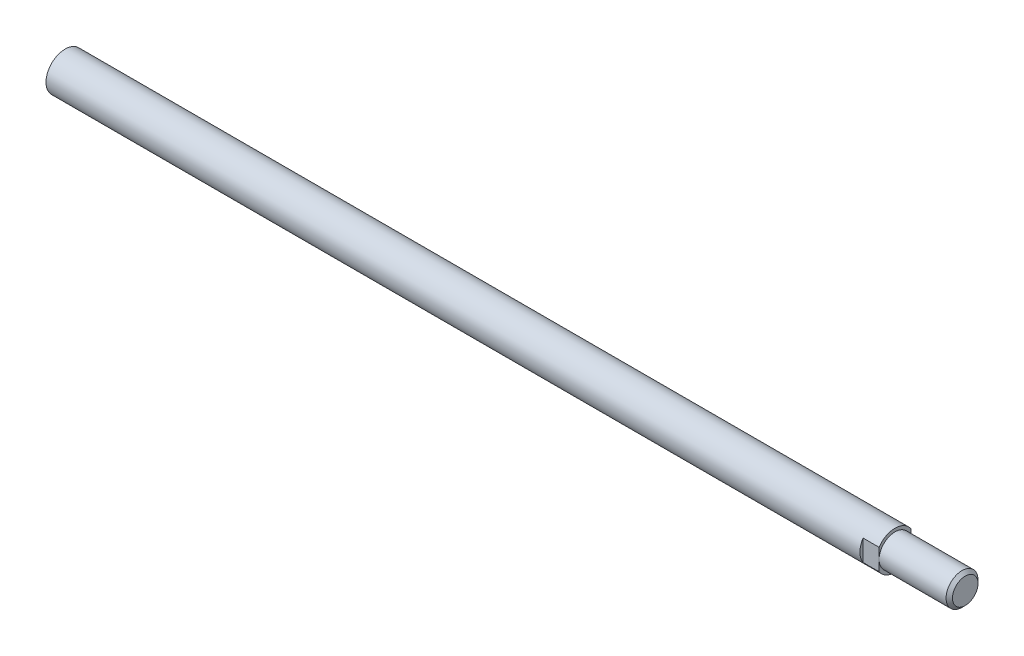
SolidWorks part; units mm, degrees
ref_plane "Vorderseite" through (0, 0, 0) normal (0, 0, 1) x (1, 0, 0)
ref_plane "oben" through (0, 0, 0) normal (0, 1, 0) x (-1, 0, 0)
ref_plane "rechts" through (0, 0, 0) normal (1, 0, 0) x (0, 0, -1)
sketch "Skizze1" plane through (0, 0, 0) normal (0, 0, 1) x (1, 0, 0)
  line L0 (25.5329, 0) -> (-263, 0) construction
  line L1 (0, 0) -> (-260, 0)
  line L2 (0, 5) -> (0, 6)
  line L3 (0, 6) -> (-260, 6)
  line L4 (-260, 0) -> (-260, 6)
  line L5 (0, 0) -> (22, 0)
  line L7 (0, 5) -> (22, 5)
  line L8 (22, 0) -> (22, 5)
  dimension "D2" = 10
  dimension "D3" = 12
  dimension "D4" = 22
  dimension "D5" = 260
revolve "Rotation1" add sketch "Skizze1" angle 360 about L0
chamfer "Fase1" distance 1 angle 45 1 edges at (22, 5, 0)
sketch "Skizze2" plane through (0, 0, 0) normal (0, 1, 0) x (-1, 0, 0)
  line L0 (-21, -5) -> (0, -5) construction
  line L1 (0, -6) -> (5, -6)
  line L2 (0, -6) -> (0, -5)
  line L3 (0, -5) -> (5, -5)
  line L4 (5, -6) -> (5, -5)
  line L5 (0, 6) -> (5, 6)
  line L6 (0, 6) -> (0, 5)
  line L7 (0, 5) -> (5, 5)
  line L8 (5, 6) -> (5, 5)
  line L9 (0, 5) -> (-21, 5) construction
  line L10 (0, 6) -> (0, -6) construction
  dimension "D1" = 5
extrude "Schnitt-Linear austragen1" cut sketch "Skizze2" against normal mid plane 12
